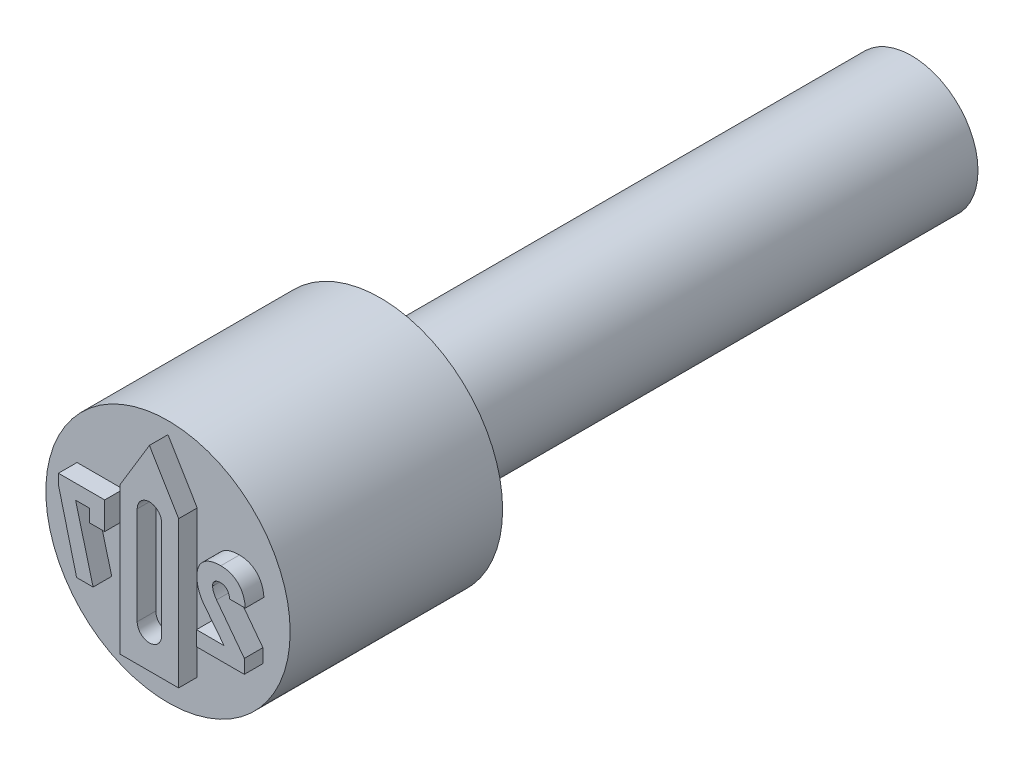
SolidWorks part; units mm, degrees
ref_plane "Front Plane" through (0, 0, 0) normal (0, 0, 1) x (1, 0, 0)
ref_plane "Top Plane" through (0, 0, 0) normal (0, 1, 0) x (1, 0, 0)
ref_plane "Right Plane" through (0, 0, 0) normal (1, 0, 0) x (0, 0, -1)
sketch "Sketch2" plane through (0, 0, 0) normal (1, 0, 0) x (0, 0, -1)
  line L0 (0.4039, 0) -> (50000.4039, 0) construction
  line L6 (0, 2.3) -> (0, 0)
  line L7 (4, 2.3) -> (0, 2.3)
  line L8 (4, 1.25) -> (4, 2.3)
  line L9 (14, 1.25) -> (4, 1.25)
  line L10 (14, 0) -> (14, 1.25)
  line L11 (0, 0) -> (14, 0)
  dimension "D1" = 4.6
  dimension "D2" = 2.5
  dimension "D3" = 14
  dimension "D4" = 4
revolve "Revolve1" add sketch "Sketch2" angle 360 about L0
sketch "Sketch3" plane through (0, 0, 0) normal (0, 0, 1) x (1, 0, 0)
  line L0 (0, 0.3526) -> (0, 100000.3526) construction
  line L1 (-0.55, -1.61) -> (0.55, -1.61)
  line L2 (0.55, -1.61) -> (0.55, 1.15)
  line L3 (0.55, 1.15) -> (0, 2.07)
  line L4 (0, 2.07) -> (-0.55, 1.1593)
  line L5 (-0.55, 1.1593) -> (-0.55, -1.61)
  text T0 "2   7" font "Bahnschrift" height 1.53
  dimension "D1" = 1.1
  dimension "D2" = 0.55
  dimension "D3" = 62
  dimension "D4" = 2.76
  dimension "D5" = 1.61
  dimension "D6" = 0.92
  dimension "D7" = 0.77
  dimension "D8" = 1.9
extrude "Boss-Extrude1" add sketch "Sketch3" along normal blind 0.35
sketch "Sketch4" plane through (0, 0, 0.35) normal (0, 0, 1) x (1, 0, 0)
  line L2 (-0.23, 0.92) -> (-0.23, -0.92)
  line L4 (0.23, 0.92) -> (0.23, -0.92)
  arc A0 (0.23, 0.92) -> (-0.23, 0.92) centre (0, 0.92) ccw
  arc A1 (-0.23, -0.92) -> (0.23, -0.92) centre (0, -0.92) ccw
  dimension "D1" = 1.84
  dimension "D2" = 0.92
  dimension "D3" = 0.46
  dimension "D4" = 0.23
extrude "Cut-Extrude1" cut sketch "Sketch4" against normal blind 0.35 contours L2 A1 L4 A0
